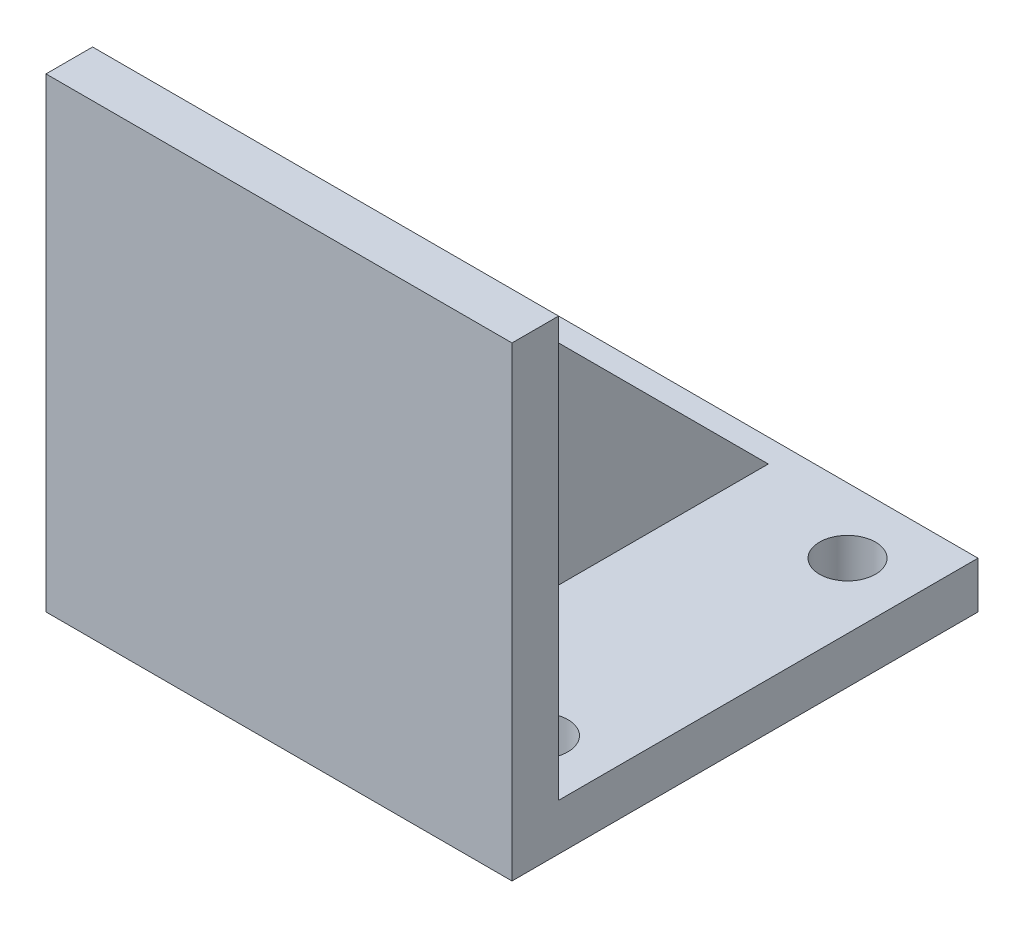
SolidWorks part; units mm, degrees
ref_plane "Alzado" through (0, 0, 0) normal (0, 0, 1) x (1, 0, 0)
ref_plane "Planta" through (0, 0, 0) normal (0, 1, 0) x (1, 0, 0)
ref_plane "Vista lateral" through (0, 0, 0) normal (1, 0, 0) x (0, 0, -1)
sketch "Croquis1" plane through (0, 0, 0) normal (1, 0, 0) x (0, 0, -1)
  line L0 (0, 0) -> (0, 100)
  line L1 (0, 100) -> (10, 100)
  line L2 (10, 100) -> (10, 10)
  line L3 (10, 10) -> (100, 10)
  line L4 (100, 10) -> (100, 0)
  line L5 (100, 0) -> (0, 0)
  dimension "D1" = 100
  dimension "D2" = 100
  dimension "D3" = 10
  dimension "D4" = 10
extrude "Extruir1" add sketch "Croquis1" along normal blind 100
sketch "Croquis3" plane through (0, 10, 0) normal (0, 1, 0) x (-1, 0, 0)
  line L3 (0, -100) -> (0, -10) construction
  line L4 (-100, -100) -> (0, -100) construction
  line L5 (-100, -100) -> (-100, -10) construction
  circle A0 centre (-86, -86) radius 6
  circle A1 centre (-14, -86) radius 6
  dimension "D1" = 12
  dimension "D2" = 12
  dimension "D3" = 14
  dimension "D4" = 14
  dimension "D5" = 14
  dimension "D6" = 14
extrude "Extruir3" cut sketch "Croquis3" against normal blind 100
ref_plane "Plano1" through (50, 0, 0) normal (1, 0, 0) x (0, 0, -1)
sketch "Croquis4" plane through (50, 0, 0) normal (1, 0, 0) x (0, 0, -1)
  line L0 (5, 100) -> (100, 5)
  line L1 (100, 0) -> (100, 10) construction
  line L2 (10, 100) -> (0, 100) construction
rib "Nervio1" sketch "Croquis4" sketch "Croquis4" thickness 20 extrusion direction parallel to sketch draft on no parameters "D1"=20
sketch "Croquis5" plane through (0, 10, 0) normal (0, 1, 0) x (1, 0, 0)
  line L0 (100, 100) -> (100, 10) construction
  line L1 (0, 100) -> (0, 10) construction
  line L2 (100, 0) -> (0, 0) construction
  circle A0 centre (14, 20) radius 6
  circle A1 centre (86, 20) radius 6
  dimension "D1" = 12
  dimension "D2" = 12
  dimension "D3" = 14
  dimension "D4" = 14
  dimension "D5" = 20
  dimension "D6" = 20
extrude "Extruir4" cut sketch "Croquis5" against normal blind 100
